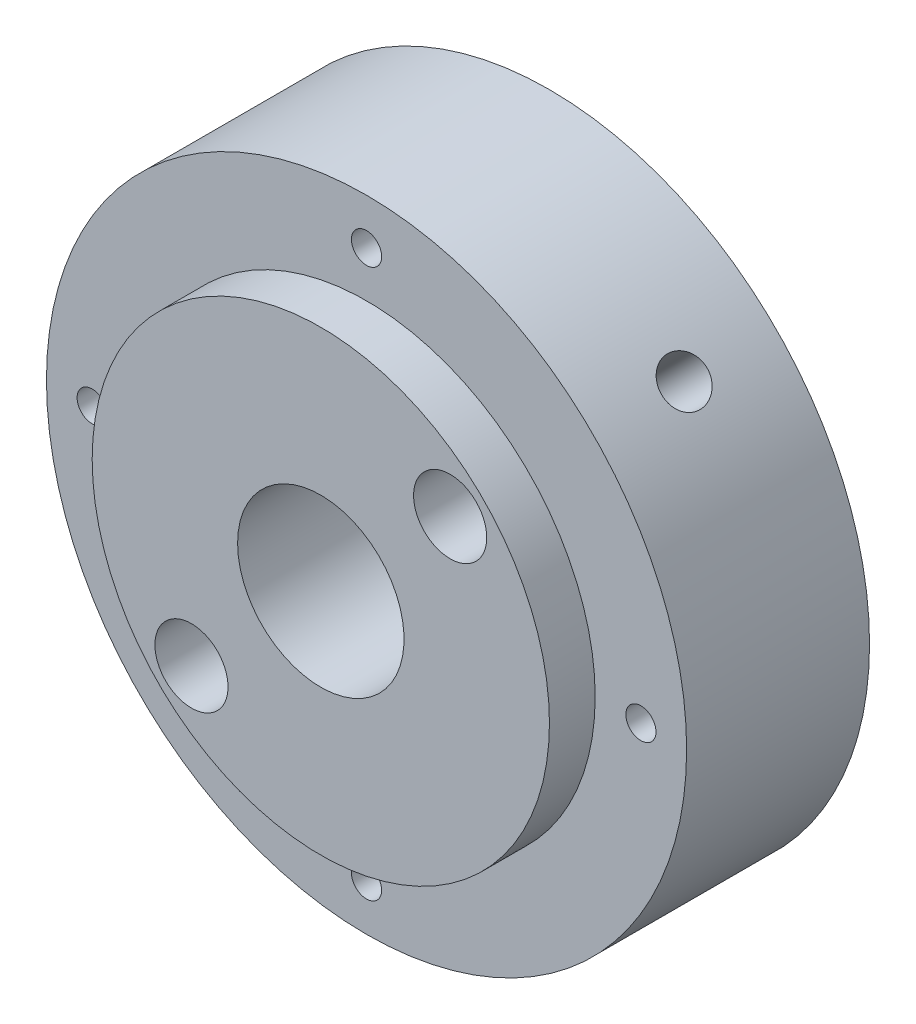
SolidWorks part; units mm, degrees
ref_plane "前视基准面" through (0, 0, 0) normal (0, 0, 1) x (1, 0, 0)
ref_plane "上视基准面" through (0, 0, 0) normal (0, 1, 0) x (1, 0, 0)
ref_plane "右视基准面" through (0, 0, 0) normal (1, 0, 0) x (0, 0, -1)
sketch "草图2" plane through (0, 0, 0) normal (0, 0, 1) x (1, 0, 0)
  circle A0 centre (0, 0) radius 9.1
  circle A1 centre (-14.1421, -14.1421) radius 4
  circle A2 centre (14.1421, 14.1421) radius 4
  circle A3 centre (0, 0) radius 35
extrude "凸台-拉伸1" add sketch "草图2" along normal blind 20
sketch "草图3" plane through (0, 0, 20) normal (0, 0, 1) x (1, 0, 0)
  circle A0 centre (0, 0) radius 25
extrude "凸台-拉伸2" add sketch "草图3" along normal blind 5
sketch "草图4" plane through (0, 0, 20) normal (0, 0, -1) x (-1, 0, 0)
  circle A0 centre (0, 0) radius 9.1
  circle A1 centre (-14.1421, 14.1421) radius 4
  circle A2 centre (14.1421, -14.1421) radius 4
extrude "切除-拉伸1" cut sketch "草图4" against normal through all
sketch "草图5" plane through (0, 0, 25) normal (0, 0, 1) x (1, 0, 0)
  circle A0 centre (0, 30) radius 1.65
  circle A1 centre (30, 0) radius 1.65
  circle A2 centre (0, -30) radius 1.65
  circle A3 centre (-30, 0) radius 1.65
extrude "切除-拉伸2" cut sketch "草图5" against normal blind 17
ref_plane "基准面4" through (24.7487, 24.7487, 0) normal (0.7071, 0.7071, 0) x (0, 0, -1)
ref_plane "基准面5" through (-24.7487, -24.7487, 0) normal (-0.7071, -0.7071, 0) x (0, 0, -1)
sketch "草图6" plane through (-24.7487, -24.7487, 0) normal (-0.7071, -0.7071, 0) x (0, 0, -1)
  circle A0 centre (-10, 0) radius 2.5
extrude "切除-拉伸3" cut sketch "草图6" against normal blind 17
sketch "草图7" plane through (24.7487, 24.7487, 0) normal (0.7071, 0.7071, 0) x (0, 0, -1)
  circle A0 centre (-10, 0) radius 2.5
extrude "切除-拉伸4" cut sketch "草图7" against normal blind 17
